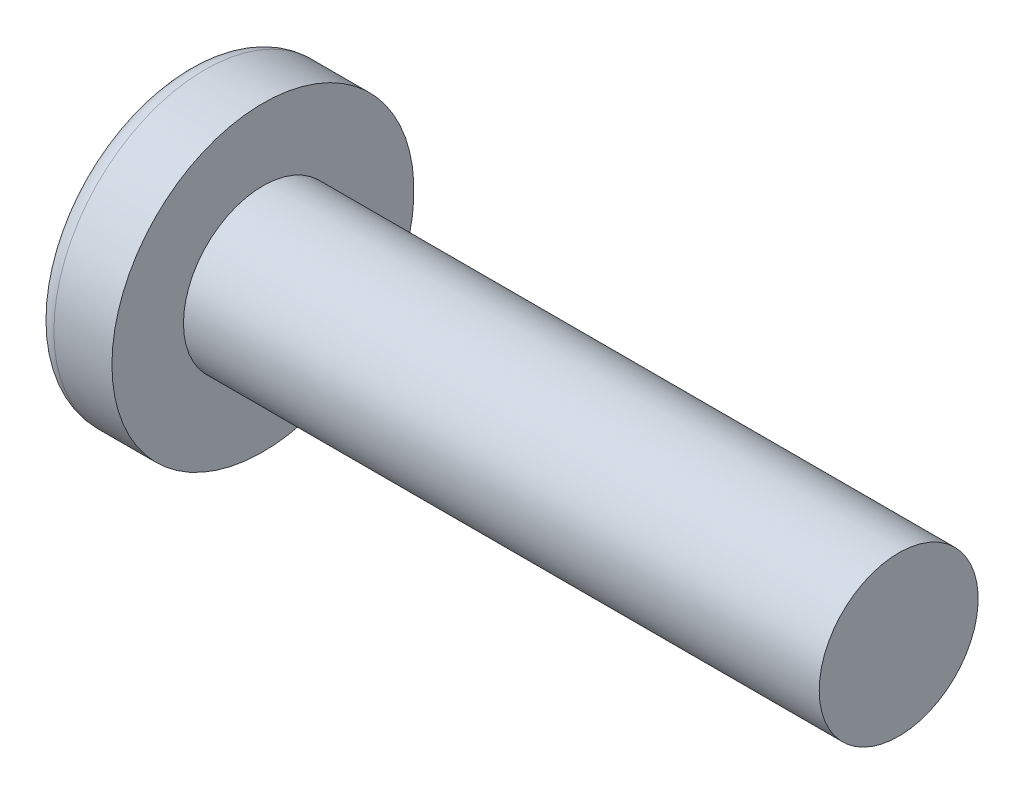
SolidWorks part; units mm, degrees
ref_plane "Plane1" through (0, 0, 0) normal (0, 0, 1) x (1, 0, 0)
ref_plane "Plane2" through (0, 0, 0) normal (0, 1, 0) x (1, 0, 0)
ref_plane "Plane3" through (0, 0, 0) normal (1, 0, 0) x (0, 0, -1)
revolve "Base-Revolve" add sketch "BodySke" angle 360 about L2
sketch "BodySke" plane through (0, 0, 0) normal (0, 0, 1) x (1, 0, 0)
  line L0 (3.7, 2.5) -> (3.7, 4.75)
  line L1 (4.5, 6.35) -> (4.5, -3.175) construction
  line L2 (-25.4, 0) -> (127, 0) construction
  line L3 (23.7, 0) -> (0, 0)
  line L4 (3.7, 2.5) -> (23.7, 2.5)
  line L5 (23.7, 2.5) -> (23.7, 0)
  line L6 (1.8732, 4.75) -> (3.7, 4.75)
  line L7 (3.7, -2.5) -> (23.7, -2.5) construction
  line L8 (3.7, 6.35) -> (3.7, -3.175) construction
  arc A0 (1.3764, 4.4865) -> (0, 0) centre (8, 0) ccw
  arc A2 (1.3764, 4.4865) -> (1.8732, 4.75) centre (1.8732, 4.15) cw
  dimension "Head_fillet_rad" = 0.6
  dimension "Head_crown_rad" = 8
  dimension "Head_ht" = 3.7
  dimension "Diameter" = 5
  dimension "Length" = 20
  dimension "Head_dia" = 9.5
  dimension "Advance" = 0.8
  dimension "Thread_nom" = 20
sketch "Sketch3" plane through (0, 0, 0) normal (1, 0, 0) x (0, 0, -1)
  line L0 (0.5, -2.45) -> (-0.5, -2.45)
  line L1 (0.5, -2.45) -> (0.5, 2.45)
  line L2 (-0.5, 2.45) -> (0.5, 2.45)
  line L3 (-0.5, 2.45) -> (-0.5, -2.45)
  dimension "D1" = 2.45
  dimension "Cross_dia" = 4.9
  dimension "D2" = 0.5
  dimension "Cross_width" = 1
ref_plane "Plane4" through (2.95, 0, 0) normal (1, 0, 0) x (0, 0, -1)
sketch "Sketch4" plane through (2.95, 0, 0) normal (1, 0, 0) x (0, 0, -1)
  line L0 (0.25, -0.25) -> (-0.25, -0.25)
  line L1 (0.25, -0.25) -> (0.25, 0.25)
  line L2 (-0.25, 0.25) -> (0.25, 0.25)
  line L3 (-0.25, 0.25) -> (-0.25, -0.25)
  dimension "D1" = 0.5
  dimension "D2" = 0.5
  dimension "D3" = 0.25
  dimension "D4" = 0.25
loft "Cut-Loft1" cut profiles "Sketch3", "Sketch4"
pattern_circular "CirPattern1" count 2 every 90 about axis through (0, 0, 0) along (1, 0, 0) of "Cut-Loft1"
sketch "ThdSchSke" plane through (0, 0, 0) normal (0, 0, 1) x (1, 0, 0)
  line L0 (4.5, -2.055) -> (4.1884, -2.5)
  line L1 (4.5, -2.055) -> (4.8116, -2.5)
  line L2 (4.8116, -2.5) -> (4.8116, -3.125)
  line L3 (-3.175, 0) -> (5.1513, 0) construction
  line L5 (4.8116, -3.125) -> (4.1884, -3.125)
  line L6 (4.1884, -3.125) -> (4.1884, -2.5)
  dimension "Thread_minor" = 4.11
  dimension "Diameter" = 5
  dimension "Start" = 4.5
  dimension "SideAngle" = 55
  dimension "VeeAngle" = 70
  dimension "Overcut" = 6.25
revolve "ThreadSchematic" cut sketch "ThdSchSke" angle 360 about L3
pattern_linear "ThdSchPat"
equation "\"D1@Sketch3\" = \"Cross_dia@Sketch3\" / 2"
equation "\"D2@Sketch3\" = \"Cross_width@Sketch3\" / 2"
equation "\"D1@Sketch4\" = \"Cross_width@Sketch3\" *.5"
equation "\"D2@Sketch4\" = \"D1@Sketch4\""
equation "\"D3@Sketch4\" = \"D1@Sketch4\" / 2"
equation "\"D4@Sketch4\" = \"D2@Sketch4\" / 2"
equation "\"Thread_length@ThreadCosmetic\" = ((sgn( (\"Length@BodySke\" - \"Advance@BodySke\" ) - \"Thread_nom@BodySke\" )-1)*( (\"Length@BodySke\" - \"Advance@BodySke\" ) - \"Thread_nom@BodySke\" ))/-2+ \"Thread_nom@BodySke\""
equation "\"Thread_minor@ThdSchSke\" = \"Thread_minor@ThreadCosmetic\""
equation "\"Diameter@ThdSchSke\" = \"Diameter@BodySke\""
equation "\"Overcut@ThdSchSke\" = \"Diameter@BodySke\" * 1.25"
equation "\"Start@ThdSchSke\" = \"Head_ht@BodySke\" + \"Length@BodySke\" - \"Thread_length@ThreadCosmetic\"  '---Non-countersunk---"
equation "\"Num_threads@ThdSchPat\" = int( \"Thread_length@ThreadCosmetic\" / \"Advance@BodySke\" + 0.999 )  + 1"
equation "\"Advance@ThdSchPat\" = \"Thread_length@ThreadCosmetic\" /  (\"Num_threads@ThdSchPat\" - 1) 'relax it"
